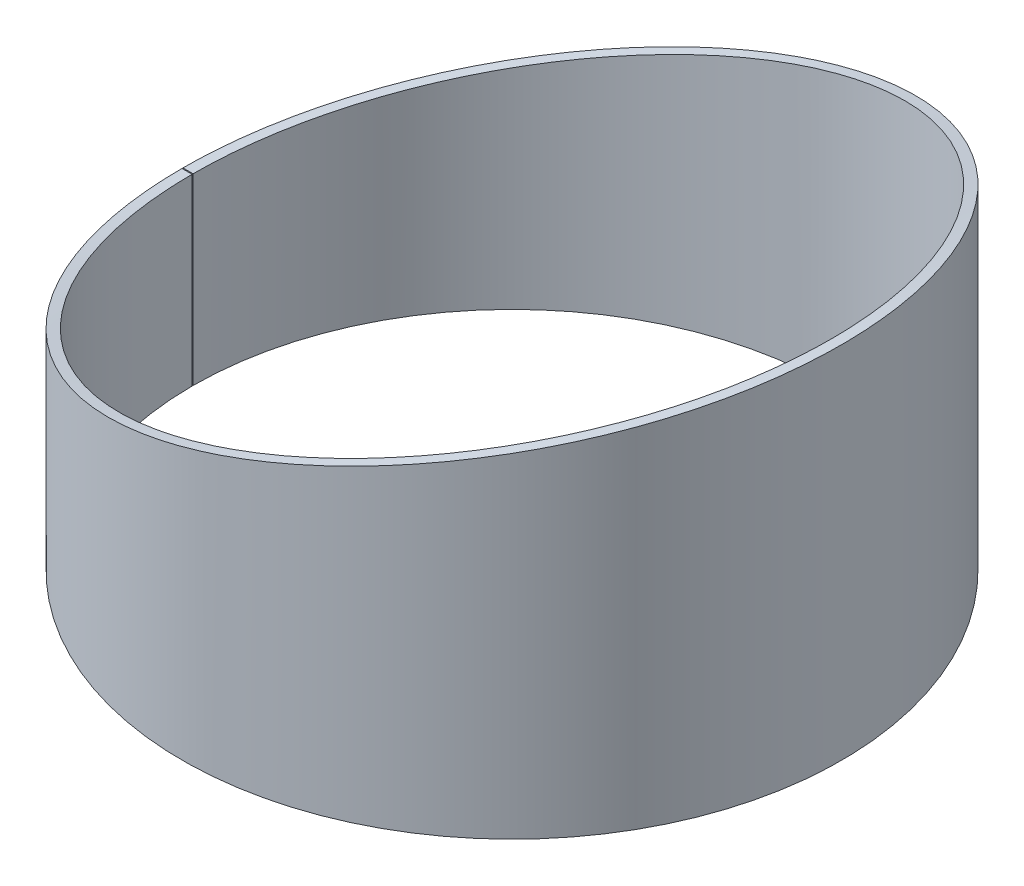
SolidWorks part; units mm, degrees
ref_plane "前视基准面" through (0, 0, 0) normal (0, 0, 1) x (1, 0, 0)
ref_plane "上视基准面" through (0, 0, 0) normal (0, 1, 0) x (1, 0, 0)
ref_plane "右视基准面" through (0, 0, 0) normal (1, 0, 0) x (0, 0, -1)
imported_body "基体零件-圆管斜插四节直角弯头-1"
sheet metal parameters "钣金1" parameters "D1"=0.7366, "厚度"=10
bend "圆角折弯1" bend radius 315 bend angle 359.824 parameters "D5"=1
flatten bends "展开-折弯1"
sketch "尖角-草图1" plane through (-324.9996, 90.4329, 0.5) normal (-1, 0, 0.0015) x (0.0015, 0, 1)
  line L0 (989.1171, 90.4329) -> (989.1171, -90.4329) construction
  dimension "D1" = 0
process bends "加工-折弯1" parameters "D1"=0
sketch "平面-草图1" plane through (-324.9996, 90.4329, 0.5) normal (-1, 0, 0.0015) x (0.0015, 0, 1)
